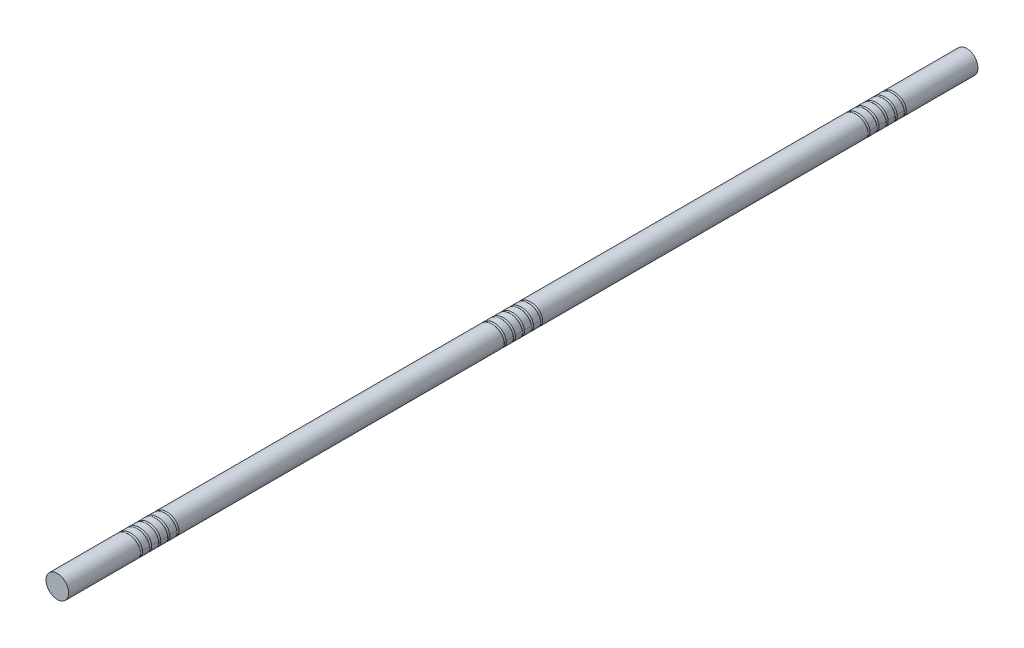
SolidWorks part; units mm, degrees
ref_plane "Front Plane" through (0, 0, 0) normal (0, 0, 1) x (1, 0, 0)
ref_plane "Top Plane" through (0, 0, 0) normal (0, 1, 0) x (1, 0, 0)
ref_plane "Right Plane" through (0, 0, 0) normal (1, 0, 0) x (0, 0, -1)
sketch "Sketch1" plane through (0, 0, 0) normal (0, 0, 1) x (1, 0, 0)
  circle A0 centre (0, 0) radius 25
  dimension "D1" = 50
extrude "Boss-Extrude1" add sketch "Sketch1" along normal blind 2000
ref_plane "Plane1" through (0, 0, 150) normal (0, 0, 1) x (1, 0, 0)
sketch "Sketch2" plane through (0, 0, 150) normal (0, 0, 1) x (1, 0, 0)
  circle A0 centre (0, 0) radius 27.1167
  dimension "D1" = 54.2333
curve "Helix/Spiral1"
sketch "Sketch3" plane through (0, 0, 0) normal (0, 1, 0) x (1, 0, 0)
  circle A0 centre (-27.1167, -150) radius 3.175
  spline S0 degree 3 number of poles 118 (-27.1167, -150) -> (-27.1167, -250) construction
  dimension "D1" = 6.35
sweep "Cut-Sweep1" cut profiles "Sketch3" path "Helix/Spiral1"
pattern_linear "LPattern1" count 3 spacing 800 along (0, 0, -1) of "Cut-Sweep1"
